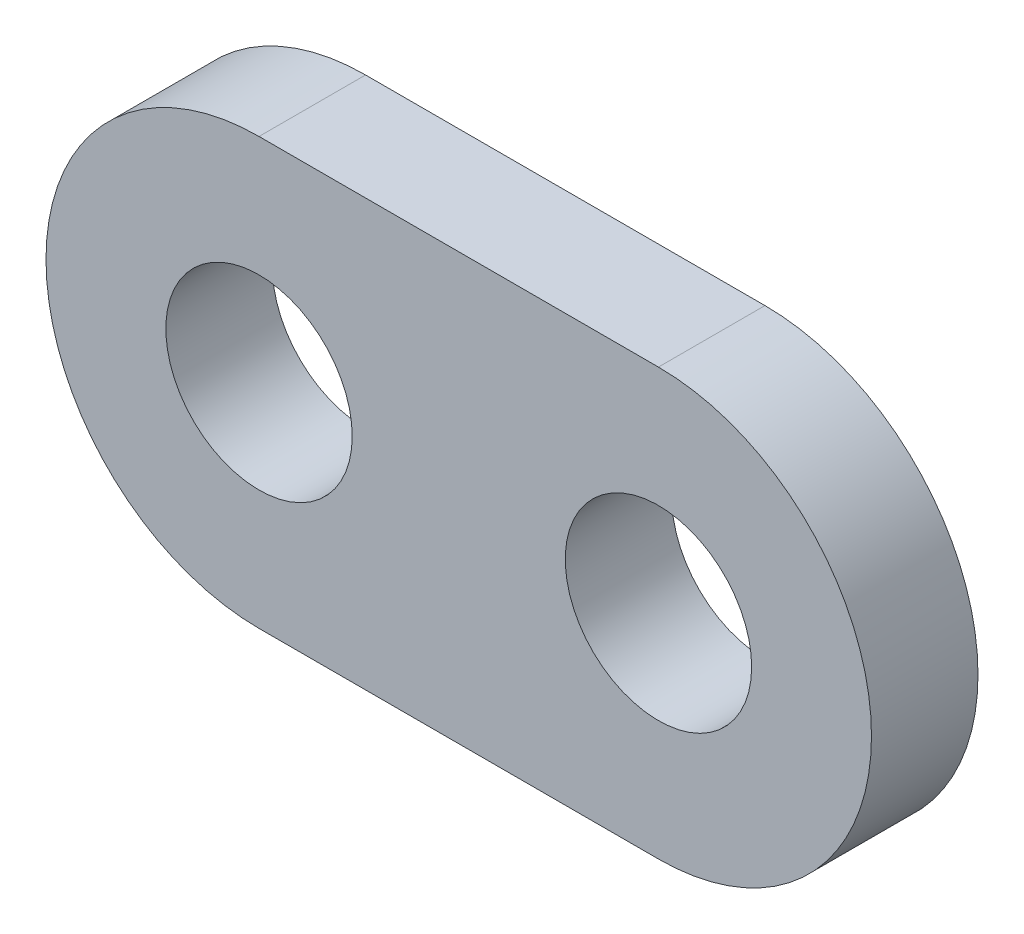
SolidWorks part; units mm, degrees
ref_plane "Front Plane" through (0, 0, 0) normal (0, 0, 1) x (1, 0, 0)
ref_plane "Top Plane" through (0, 0, 0) normal (0, 1, 0) x (1, 0, 0)
ref_plane "Right Plane" through (0, 0, 0) normal (1, 0, 0) x (0, 0, -1)
sketch "Sketch1" plane through (0, 0, 0) normal (0, 0, 1) x (1, 0, 0)
  line L0 (0, 0) -> (75, 0)
  line L1 (75, 80) -> (0, 80)
  arc A0 (75, 0) -> (75, 80) centre (75, 40) ccw
  arc A1 (0, 80) -> (0, 0) centre (0, 40) ccw
  circle A2 centre (0, 40) radius 17.5
  circle A3 centre (75, 40) radius 17.5
  dimension "D2" = 40
  dimension "D3" = 35
  dimension "D1" = 75
extrude "Extrude1" add sketch "Sketch1" along normal blind 20
